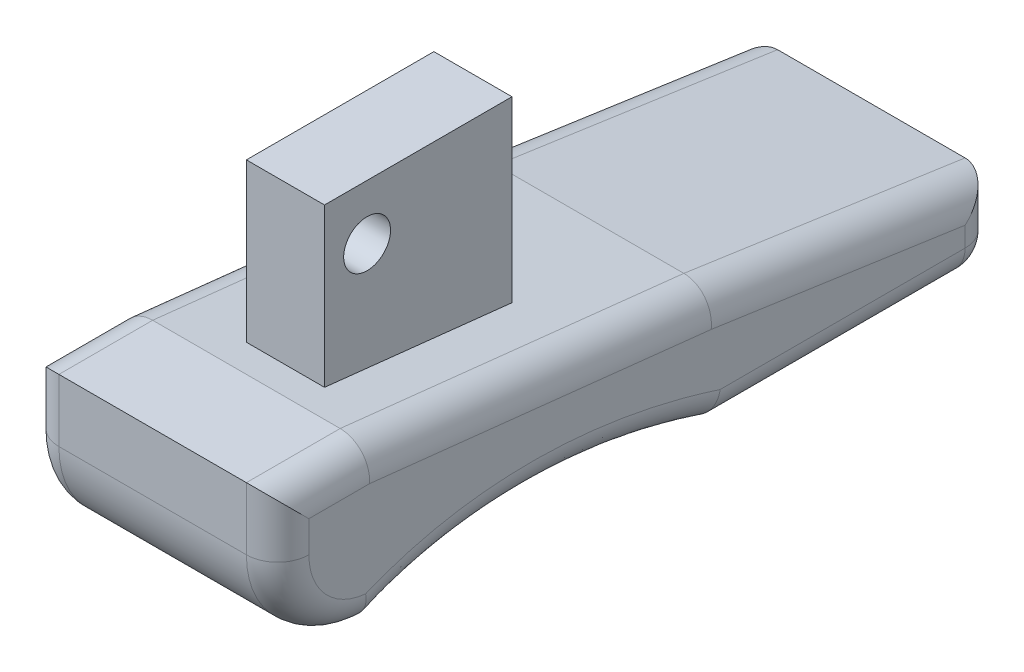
SolidWorks part; units mm, degrees
ref_plane "Front Plane" through (0, 0, 0) normal (0, 0, 1) x (1, 0, 0)
ref_plane "Top Plane" through (0, 0, 0) normal (0, 1, 0) x (1, 0, 0)
ref_plane "Right Plane" through (0, 0, 0) normal (1, 0, 0) x (0, 0, -1)
sketch "Sketch1" plane through (0, 0, 0) normal (1, 0, 0) x (0, 0, -1)
  line L0 (-91.117, 0) -> (-110, 0) construction
  line L1 (-140, 0) -> (-140, 50)
  line L2 (-140, 50) -> (-110, 50)
  line L3 (90, 25) -> (90, 0)
  line L4 (90, 0) -> (0, 0)
  line L5 (0, -64.1779) -> (0, 98.5738) construction
  line L6 (-110, -64.1779) -> (-110, 90.1846) construction
  line L7 (0, 0) -> (90, 0) construction
  line L8 (-110, 0) -> (-140, 0)
  line L9 (60, 0) -> (60, 78.5561) construction
  line L10 (-208.9932, 12.0027) -> (104.4279, 15.7971) construction
  line L11 (-110, 50) -> (0, 38)
  line L12 (0, 38) -> (90, 25)
  spline S0 degree 3 poles (-110, 0) (-75.3453, 15.191) (-35.0572, 11.7308) (0, 0) knots 0 0 0 0 1 1 1 1
  point P8 (90, 12.5)
  dimension "D1" = 230
  dimension "D2" = 30
  dimension "D3" = 110
  dimension "D4" = 30
  dimension "D5" = 50
  dimension "D6" = 25
  dimension "D7" = 38
extrude "Boss-Extrude1" add sketch "Sketch1" along normal blind 80
fillet "Fillet1" radius 30 1 edges at (40, 0, 140)
fillet "Fillet2" radius 10 1 edges at (40, 0, -90)
fillet "Fillet3" radius 10 18 edges at (0, 31.5, -45) (0, 44, 55) (0, 50, 125) (0, 40, 140) (0, 8.7868, 131.2132) (0, 0, -40) (0, 2.9289, -87.0711) (0, 17.5, -90) (80, 8.7868, 131.2132) (80, 40, 140) (80, 50, 125) (80, 44, 55) (80, 31.5, -45) (80, 17.5, -90) (80, 2.9289, -87.0711) (80, 0, -40)
ref_plane "Plane1" through (55, 0, 0) normal (1, 0, 0) x (0, 0, -1)
sketch "Sketch2" plane through (55, 0, 0) normal (1, 0, 0) x (0, 0, -1)
  line L0 (-100, 42.3636) -> (-100, 99.4567)
  line L2 (-100, 99.4567) -> (-40, 99.4567)
  line L3 (-40, 99.4567) -> (-40, 42.3636)
  line L4 (-110, 50) -> (0, 38) construction
  line L5 (-40, 42.3636) -> (-100, 42.3636)
  line L6 (-140, 50) -> (-140, 126.0183) construction
  dimension "D1" = 60
  dimension "D2" = 40
extrude "Boss-Extrude2" add sketch "Sketch2" against normal blind 25
sketch "Sketch3" plane through (55, 0, 0) normal (1, 0, 0) x (0, 0, -1)
  line L0 (-40, 81.9142) -> (-135.9577, 81.9142) construction
  line L1 (-40, 42.3636) -> (-40, 99.4567) construction
  line L2 (-86.3689, 99.4567) -> (-86.3689, 60.3539) construction
  line L3 (-40, 99.4567) -> (-100, 99.4567) construction
  circle A0 centre (-86.3689, 81.9142) radius 7.5
  dimension "D1" = 15
extrude "Cut-Extrude1" cut sketch "Sketch3" against normal blind 28
sketch "Sketch4" plane through (55, 0, 0) normal (1, 0, 0) x (0, 0, -1)
